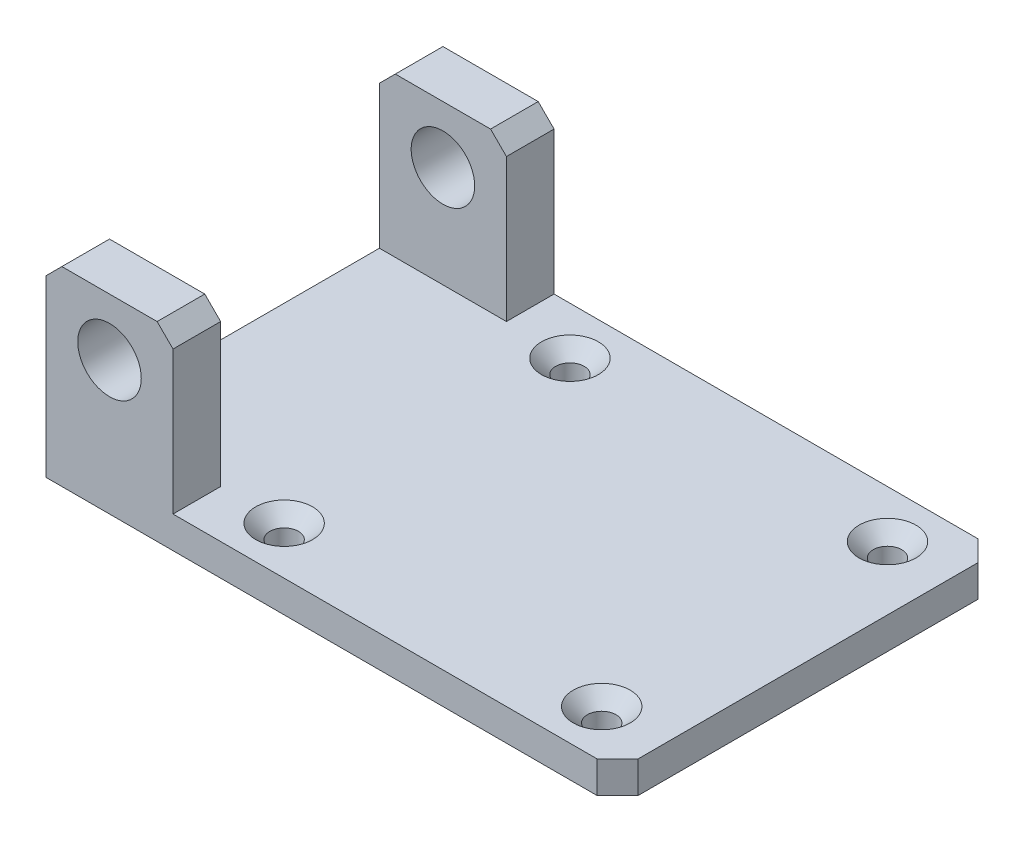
SolidWorks part; units mm, degrees
ref_plane "Front" through (0, 0, 0) normal (0, 0, 1) x (1, 0, 0)
ref_plane "Top" through (0, 0, 0) normal (0, 1, 0) x (1, 0, 0)
ref_plane "Right" through (0, 0, 0) normal (1, 0, 0) x (0, 0, -1)
sketch "Sketch2" plane through (0, 0, 0) normal (0, 1, 0) x (1, 0, 0)
  line L1 (90, -60) -> (-90, -60)
  line L2 (90, -60) -> (90, 60)
  line L3 (90, 60) -> (-90, 60)
  line L4 (-90, -60) -> (-90, 60)
  line L5 (90, -60) -> (-90, 60) construction
  line L6 (90, 60) -> (-90, -60) construction
  point P0 (0, 0)
  dimension "D1" = 180
  dimension "D2" = 120
extrude "Boss-Extrude1" add sketch "Sketch2" along normal blind 10
sketch "Sketch4" plane through (0, 0, 60) normal (0, 0, 1) x (1, 0, 0)
  line L0 (-70, 60) -> (-70, 10) construction
  line L1 (-90, 10) -> (-50, 10)
  line L2 (-90, 10) -> (-90, 60)
  line L3 (-90, 60) -> (-50, 60)
  line L4 (-50, 10) -> (-50, 60)
  line L5 (-90, 10) -> (90, 10) construction
  circle A0 centre (-70, 42) radius 10
  dimension "D1" = 20
  dimension "D2" = 50
  dimension "D3" = 18
  dimension "D4" = 40
extrude "Boss-Extrude2" add sketch "Sketch4" against normal blind 15
chamfer "Chamfer1" distance 5 angle 45 2 edges at (-90, 60, 52.5) (-50, 60, 52.5)
mirror "Mirror1" about plane through (0, 0, 0) normal (0, 0, 1) of "Chamfer1", "Boss-Extrude2"
chamfer "Chamfer3" distance 6.5 angle 45 2 edges at (90, 5, -60) (90, 5, 60)
hole_wizard "CSK for M8 Hex Socket Countersunk Cap Screw1" positions "Sketch5" profile "Sketch6" countersink size "M8" standard "ISO"
sketch "Sketch5" plane through (0, 10, 0) normal (0, 1, 0) x (1, 0, 0)
  line L1 (-30, 45) -> (70, 45)
  line L2 (-30, 45) -> (-30, -45)
  line L3 (-30, -45) -> (70, -45)
  line L4 (70, 45) -> (70, -45)
  line L5 (0, 0) -> (70, 0) construction
  line L7 (90, -53.5) -> (90, 53.5) construction
  point P0 (-30, -45)
  point P2 (70, -45)
  point P8 (-30, 45)
  point P10 (70, 45)
  dimension "D1" = 90
  dimension "D2" = 20
  dimension "D3" = 100
sketch "Sketch6" plane through (-30, 10, 45) normal (1, 0, 0) x (0, 0, 1)
  line L0 (0, 0) -> (0, 10)
  line L1 (0, 10) -> (4.5, 10)
  line L2 (4.5, 10) -> (4.5, 4.46)
  line L3 (4.5, 4.46) -> (8.96, 0)
  line L5 (8.96, 0) -> (0, 0)
  line L6 (-4.5, 4.46) -> (-8.96, 0) construction
  line L11 (0, -6.35) -> (0, 107.95) construction
  dimension "Thru Hole Dia." = 9
  dimension "Thru Hole Depth" = 10
  dimension "Near C'Sink Dia." = 17.92
  dimension "Near C'Sink Angle" = 90
